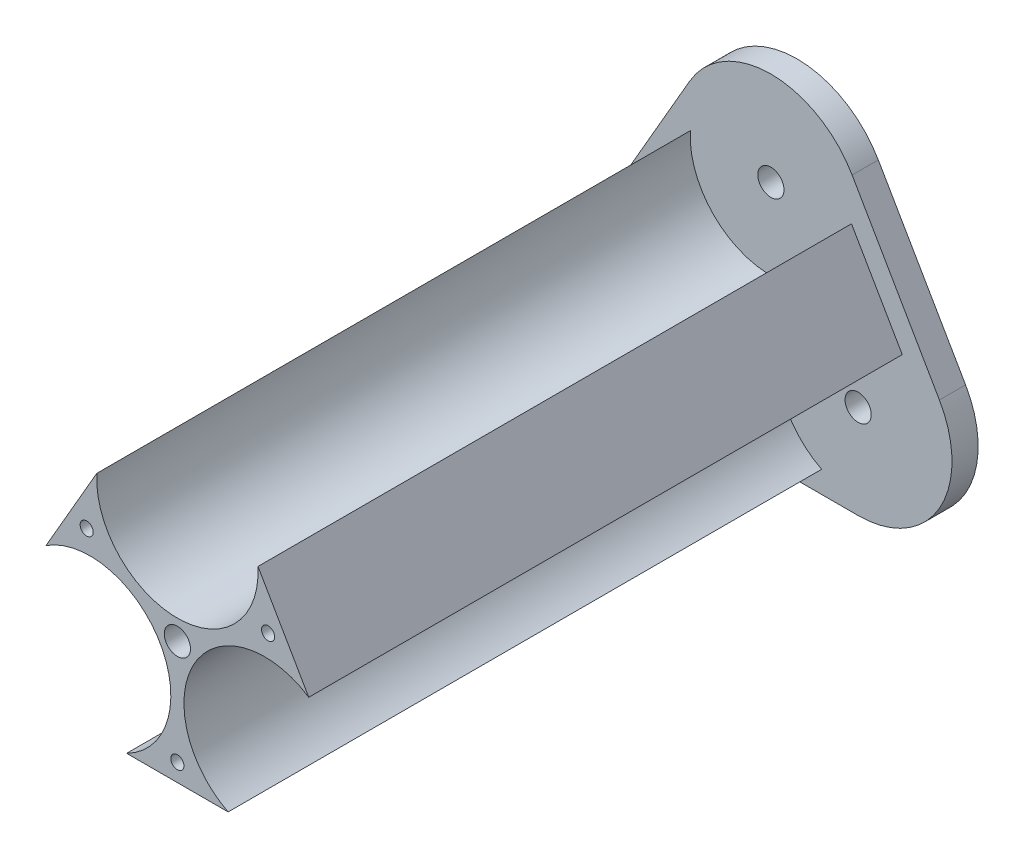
SolidWorks part; units mm, degrees
ref_plane "Спереди" through (0, 0, 0) normal (0, 0, 1) x (1, 0, 0)
ref_plane "Сверху" through (0, 0, 0) normal (0, 1, 0) x (1, 0, 0)
ref_plane "Справа" through (0, 0, 0) normal (1, 0, 0) x (0, 0, -1)
sketch "Эскиз1" plane through (0, 0, 0) normal (0, 0, 1) x (1, 0, 0)
  line L0 (-10, 0) -> (10, 0)
  line L1 (0, 0) -> (0, 19.0027) construction
  line L2 (-9.3098, 33.4455) -> (-19.3098, 16.125)
  line L3 (9.3098, 33.4455) -> (19.3098, 16.125)
  arc A0 (-10, 0) -> (-19.3098, 16.125) centre (-10, 10.75) cw
  arc A1 (10, 0) -> (19.3098, 16.125) centre (10, 10.75) ccw
  arc A2 (-9.3098, 33.4455) -> (9.3098, 33.4455) centre (0, 28.0705) cw
  dimension "D2" = 10.75
  dimension "D3" = 10.75
  dimension "D1" = 20
extrude "Бобышка-Вытянуть1" add sketch "Эскиз1" along normal blind 3
sketch "Эскиз2" plane through (0, 0, 3) normal (0, 0, 1) x (1, 0, 0)
  line L0 (0, 38.8205) -> (0, 0) construction
  line L1 (0, 16.5235) -> (19.3098, 5.375) construction
  line L2 (0, 16.5235) -> (-19.3098, 5.375) construction
  line L3 (-5.8167, 2.5) -> (5.8167, 2.5)
  line L4 (-10, 0) -> (10, 0) construction
  line L5 (9.2364, 28.5727) -> (15.0531, 18.4978)
  line L6 (19.3098, 16.125) -> (9.3098, 33.4455) construction
  line L7 (-9.2364, 28.5727) -> (-15.0531, 18.4978)
  line L8 (-9.3098, 33.4455) -> (-19.3098, 16.125) construction
  arc A0 (-9.2364, 28.5727) -> (9.2364, 28.5727) centre (0, 28.0705) ccw
  arc A1 (15.0531, 18.4978) -> (5.8167, 2.5) centre (10, 10.75) ccw
  arc A2 (-5.8167, 2.5) -> (-15.0531, 18.4978) centre (-10, 10.75) ccw
  arc A3 (9.3098, 33.4455) -> (-9.3098, 33.4455) centre (0, 28.0705) ccw construction
  arc A4 (10, 0) -> (19.3098, 16.125) centre (10, 10.75) ccw construction
  arc A6 (-19.3098, 16.125) -> (-10, 0) centre (-10, 10.75) ccw construction
  circle A7 centre (0, 16.5235) radius 1.5
  dimension "D1" = 18.5
  dimension "D2" = 18.5
  dimension "D3" = 18.5
  dimension "D4" = 3
  dimension "D5" = 2.5
  dimension "D6" = 2.5
  dimension "D7" = 2.5
extrude "Бобышка-Вытянуть2" add sketch "Эскиз2" along normal blind 68
sketch "Эскиз3" plane through (0, 0, 71) normal (0, 0, 1) x (1, 0, 0)
  line L0 (0, 16.5235) -> (12.1447, 23.5353) construction
  line L1 (15.0531, 18.4978) -> (9.2364, 28.5727) construction
  line L2 (0, 16.5235) -> (-12.1447, 23.5353) construction
  line L3 (-9.2364, 28.5727) -> (-15.0531, 18.4978) construction
  line L4 (0, 16.5235) -> (0, 2.5) construction
  line L5 (-5.8167, 2.5) -> (5.8167, 2.5) construction
  circle A0 centre (10.3923, 22.5235) radius 0.75
  circle A1 centre (0, 4.5235) radius 0.75
  circle A2 centre (-10.3923, 22.5235) radius 0.75
  circle A3 centre (0, 16.5235) radius 12 construction
  dimension "D1" = 1.5
  dimension "D4" = 24
extrude "Вырез-Вытянуть1" cut sketch "Эскиз3" against normal blind 15
sketch "Эскиз4" plane through (0, 0, 3) normal (0, 0, 1) x (1, 0, 0)
  circle A0 centre (0, 28.0705) radius 1.5
  circle A1 centre (10, 10.75) radius 1.5
  circle A2 centre (-10, 10.75) radius 1.5
  arc A3 (-19.3098, 16.125) -> (-10, 0) centre (-10, 10.75) ccw construction
  arc A4 (9.3098, 33.4455) -> (-9.3098, 33.4455) centre (0, 28.0705) ccw construction
  arc A5 (10, 0) -> (19.3098, 16.125) centre (10, 10.75) ccw construction
  dimension "D1" = 3
extrude "Вырез-Вытянуть2" cut sketch "Эскиз4" against normal through all
sketch "Эскиз5" plane through (0, 0, 3) normal (0, 0, 1) x (1, 0, 0)
  circle A1 centre (0, 16.5235) radius 1.5
  circle A2 centre (0, 16.5235) radius 1.5
  dimension "D1" = 0
extrude "Вырез-Вытянуть3" cut sketch "Эскиз5" against normal through all
